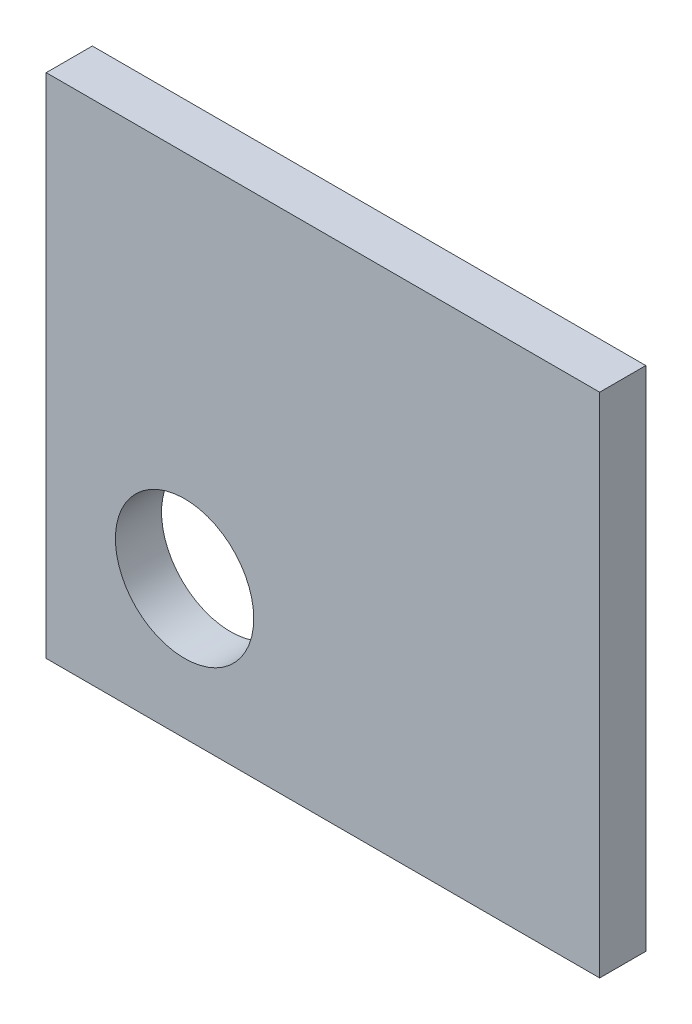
SolidWorks part; units mm, degrees
ref_plane "Front" through (0, 0, 0) normal (0, 0, 1) x (1, 0, 0)
ref_plane "Top" through (0, 0, 0) normal (0, 1, 0) x (1, 0, 0)
ref_plane "Right" through (0, 0, 0) normal (1, 0, 0) x (0, 0, -1)
sketch "Sketch1" plane through (0, 0, 0) normal (0, 0, 1) x (1, 0, 0)
  line L1 (0, 0) -> (76.2, 0)
  line L2 (0, 0) -> (0, 69.85)
  line L3 (0, 69.85) -> (76.2, 69.85)
  line L4 (76.2, 0) -> (76.2, 69.85)
  circle A0 centre (19.05, 19.05) radius 9.525
  dimension "D3" = 19.05
  dimension "D4" = 19.05
  dimension "D5" = 19.05
  dimension "D1" = 76.2
  dimension "D2" = 69.85
extrude "Extrude1" add sketch "Sketch1" along normal blind 6.35
